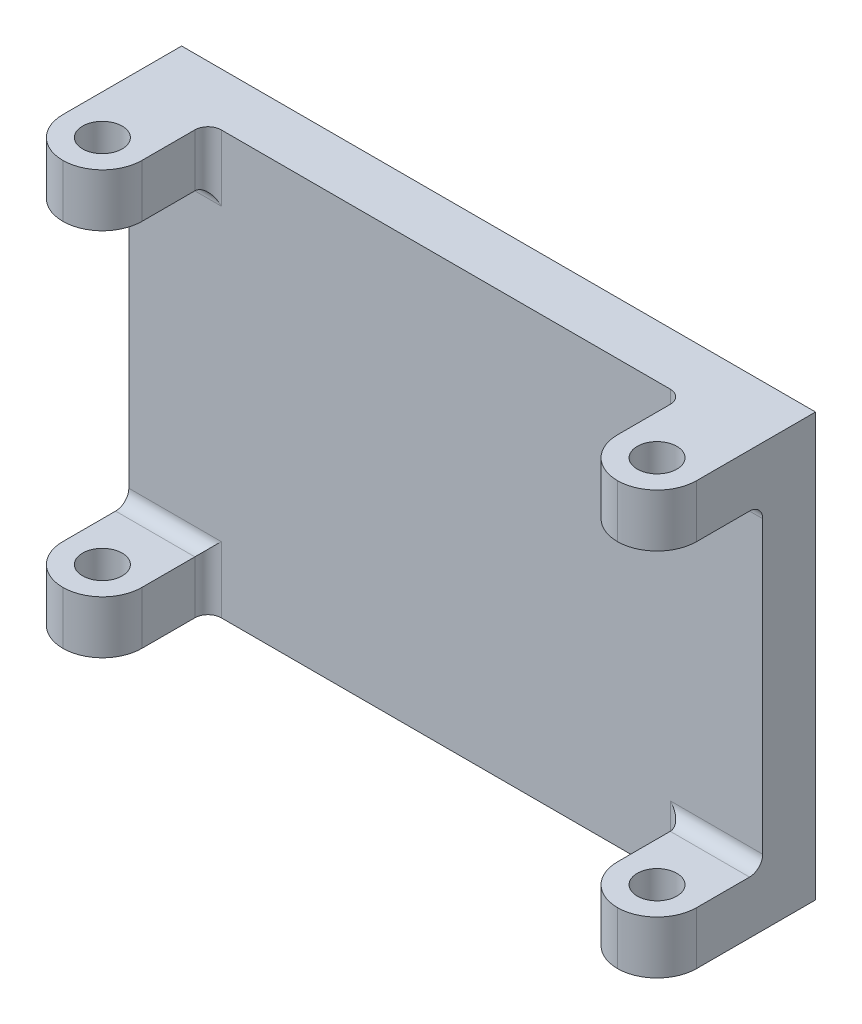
SolidWorks part; units mm, degrees
ref_plane "Front Plane" through (0, 0, 0) normal (0, 0, 1) x (1, 0, 0)
ref_plane "Top Plane" through (0, 0, 0) normal (0, 1, 0) x (1, 0, 0)
ref_plane "Right Plane" through (0, 0, 0) normal (1, 0, 0) x (0, 0, -1)
sketch "Sketch2" plane through (0, 0, 0) normal (0, 0, 1) x (1, 0, 0)
  line L0 (0, 0) -> (137.829, 0) construction
  line L1 (0, 0) -> (0, 93.6852) construction
  line L3 (-152.4, -101.6) -> (152.4, -101.6)
  line L4 (-152.4, -101.6) -> (-152.4, 101.6)
  line L5 (-152.4, 101.6) -> (152.4, 101.6)
  line L6 (152.4, -101.6) -> (152.4, 101.6)
  dimension "D1" = 304.8
  dimension "D2" = 203.2
  dimension "D3" = 152.4
  dimension "D4" = 101.6
extrude "Extrude2" add sketch "Sketch2" along normal blind 25.4
sketch "Sketch3" plane through (0, 0, 25.4) normal (0, 0, 1) x (1, 0, 0)
  line L1 (-152.4, -101.6) -> (-114.3, -101.6)
  line L2 (-152.4, -101.6) -> (-152.4, -76.2)
  line L3 (-152.4, -76.2) -> (-114.3, -76.2)
  line L4 (-114.3, -101.6) -> (-114.3, -76.2)
  dimension "D1" = 38.1
  dimension "D2" = 25.4
extrude "Extrude3" add sketch "Sketch3" along normal blind 50.8
fillet "Fillet1" radius 19.05 2 edges at (-114.3, -88.9, 76.2) (-152.4, -88.9, 76.2)
sketch "Sketch4" plane through (0, -101.6, 0) normal (0, -1, 0) x (1, 0, 0)
  circle A0 centre (-133.35, 57.15) radius 9.525
  arc A1 (-133.35, 76.2) -> (-152.4, 57.15) centre (-133.35, 57.15) ccw construction
  dimension "D1" = 19.05
extrude "Cut-Extrude1" cut sketch "Sketch4" against normal through all
mirror "Mirror1" about plane through (0, 0, 0) normal (1, 0, 0) of "Cut-Extrude1", "Fillet1", "Extrude3"
mirror "Mirror2" about plane through (0, 0, 0) normal (0, 1, 0) of "Mirror1", "Cut-Extrude1", "Fillet1", "Extrude3"
fillet "Fillet2" radius 6.35 8 edges at (114.3, 88.9, 25.4) (114.3, -88.9, 25.4) (-114.3, 88.9, 25.4) (-133.35, 76.2, 25.4) (133.35, 76.2, 25.4) (133.35, -76.2, 25.4)
equation "\"D3@Sketch2\" = \"D1@Sketch2\"/2"
